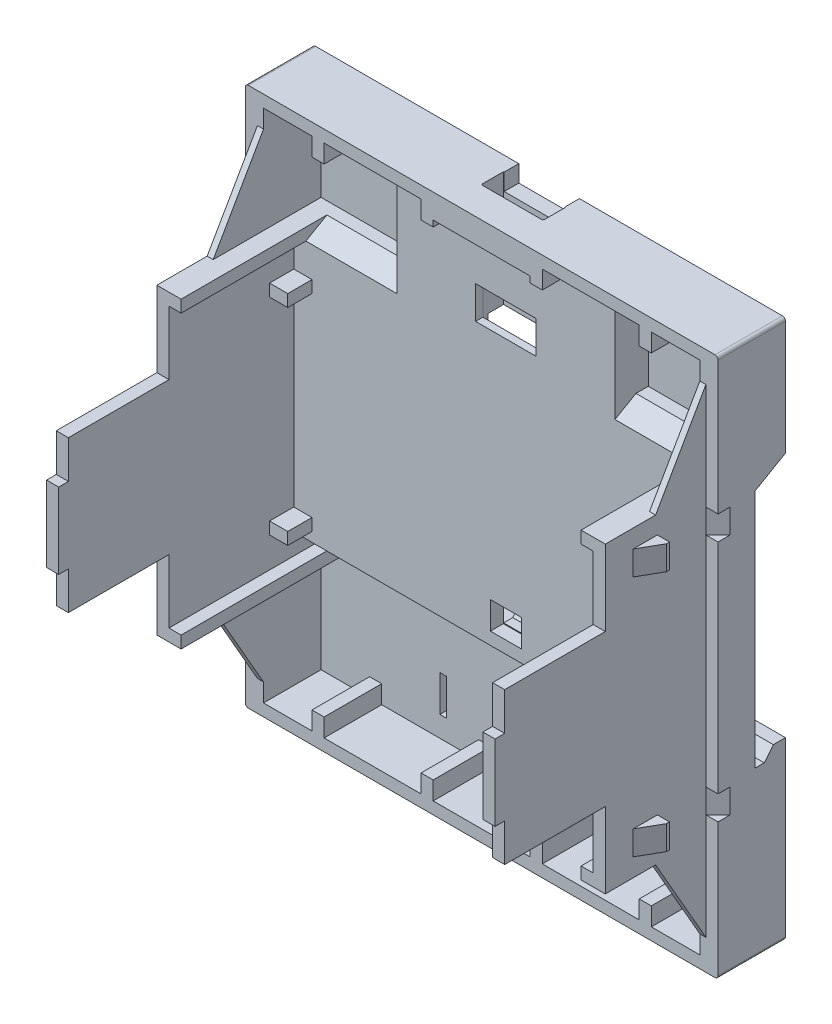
SolidWorks part; units mm, degrees
ref_plane "Alzado" through (0, 0, 0) normal (0, 0, 1) x (1, 0, 0)
ref_plane "Planta" through (0, 0, 0) normal (0, 1, 0) x (1, 0, 0)
ref_plane "Vista lateral" through (0, 0, 0) normal (1, 0, 0) x (0, 0, -1)
imported_body "GAINTA_D2MG_BASE_0.stp-1-solid1"
sketch "Croquis1" plane through (0, 0, 7.8033) normal (0, 0, 1) x (1, 0, 0)
  line L0 (23.9305, 33.3693) -> (25.6795, 33.3693) construction
  line L1 (-10.6205, 39.3693) -> (-8.8716, 39.3693)
  line L2 (-10.6205, 39.3693) -> (-10.6205, 33.3693)
  line L3 (-10.6205, 33.3693) -> (-8.8716, 33.3693)
  line L4 (-8.8716, 39.3693) -> (-8.8716, 33.3693)
  line L5 (-10.6205, -33.0907) -> (-8.8716, -33.0907)
  line L6 (-10.6205, -33.0907) -> (-10.6205, -39.0907)
  line L7 (-10.6205, -39.0907) -> (-8.8716, -39.0907)
  line L8 (-8.8716, -33.0907) -> (-8.8716, -39.0907)
  line L9 (25.6795, -33.0907) -> (23.9305, -33.0907)
  line L10 (25.6795, -33.0907) -> (25.6795, -39.0907)
  line L11 (25.6795, -39.0907) -> (23.9305, -39.0907)
  line L12 (23.9305, -33.0907) -> (23.9305, -39.0907)
  line L13 (25.6795, 39.3693) -> (23.9305, 39.3693)
  line L14 (25.6795, 39.3693) -> (25.6795, 33.3693)
  line L15 (25.6795, 33.3693) -> (23.9305, 33.3693)
  line L16 (23.9305, 39.3693) -> (23.9305, 33.3693)
  line L17 (23.9305, -43.3107) -> (23.9305, 43.5893) construction
extrude "Saliente-Extruir1" add sketch "Croquis1" against normal blind 7.13
sketch "Croquis2" plane through (0, 0, 10.3033) normal (0, 0, 1) x (1, 0, 0)
  line L4 (23.9305, 43.5893) -> (-8.8716, 43.5893)
  line L5 (-8.8716, 43.5893) -> (-8.8716, -43.3107)
  line L6 (-8.8716, -43.3107) -> (23.9305, -43.3107)
  line L7 (23.9305, -43.3107) -> (23.9305, 43.5893)
  line L8 (23.9305, 43.5893) -> (-8.8716, 43.5893)
  line L9 (-8.8716, 43.5893) -> (-8.8716, -43.3107)
  line L10 (-8.8716, -43.3107) -> (23.9305, -43.3107)
  line L11 (23.9305, -43.3107) -> (23.9305, 43.5893)
  dimension "D1" = 0
extrude "Cortar-Extruir1" cut sketch "Croquis2" against normal blind 2.5
sketch "Croquis3" plane through (0, 0, 7.8033) normal (0, 0, 1) x (1, 0, 0)
  line L0 (-10.6205, 0.0149) -> (25.6795, 0.0149) construction
  line L1 (-10.6205, 45.2393) -> (-10.6205, -45.2096) construction
  line L2 (25.6795, -45.2096) -> (25.6795, 45.2393) construction
  line L5 (25.6795, -45.2096) -> (-10.6205, -45.2096)
  line L7 (25.6795, -45.2096) -> (25.6795, -44.4896)
  line L8 (25.6795, -44.4896) -> (-10.6205, -44.4896)
  line L9 (-10.6205, -45.2096) -> (-10.6205, -44.4896)
  line L10 (-10.6205, 45.2393) -> (25.6795, 45.2393)
  line L11 (-10.6205, 45.2393) -> (-10.6205, 44.5193)
  line L12 (-10.6205, 44.5193) -> (25.6795, 44.5193)
  line L13 (25.6795, 45.2393) -> (25.6795, 44.5193)
extrude "Cortar-Extruir2" cut sketch "Croquis3" against normal blind 7.13
sketch "Croquis5" plane through (-10.6205, 0, 0) normal (-1, 0, 0) x (0, 0, 1)
  line L8 (0.6733, -44.4896) -> (7.8033, -44.4896)
  line L9 (7.8033, -44.4896) -> (7.8033, 44.5193)
  line L10 (7.8033, 44.5193) -> (0.6733, 44.5193)
  line L11 (0.6733, 44.5193) -> (0.6733, 25.1393)
  line L12 (0.6733, 25.1393) -> (5.6733, 22.2526)
  line L13 (5.6733, 22.2526) -> (5.6733, -17.8607)
  line L14 (5.6733, -17.8607) -> (0.6733, -17.8607)
  line L15 (0.6733, -17.8607) -> (0.6733, -44.4896)
  line L16 (0.6733, -44.4896) -> (7.8033, -44.4896)
  line L17 (7.8033, -44.4896) -> (7.8033, 44.5193)
  line L18 (7.8033, 44.5193) -> (0.6733, 44.5193)
  line L19 (0.6733, 44.5193) -> (0.6733, 25.1393)
  line L20 (0.6733, 25.1393) -> (5.6733, 22.2526)
  line L21 (5.6733, 22.2526) -> (5.6733, -17.8607)
  line L22 (5.6733, -17.8607) -> (0.6733, -17.8607)
  line L23 (0.6733, -17.8607) -> (0.6733, -44.4896)
  dimension "D1" = 0
extrude "Saliente-Extruir2" add sketch "Croquis5" along normal blind 20.85
sketch "Croquis6" plane through (25.6795, 0, 0) normal (1, 0, 0) x (0, 0, -1)
  line L8 (-7.8033, -44.4896) -> (-0.6733, -44.4896)
  line L9 (-0.6733, -44.4896) -> (-0.6733, -17.8607)
  line L10 (-0.6733, -17.8607) -> (-5.6733, -17.8607)
  line L11 (-5.6733, -17.8607) -> (-5.6733, 22.2526)
  line L12 (-5.6733, 22.2526) -> (-0.6733, 25.1393)
  line L13 (-0.6733, 25.1393) -> (-0.6733, 44.5193)
  line L14 (-0.6733, 44.5193) -> (-7.8033, 44.5193)
  line L15 (-7.8033, 44.5193) -> (-7.8033, -44.4896)
  line L16 (-7.8033, -44.4896) -> (-0.6733, -44.4896)
  line L17 (-0.6733, -44.4896) -> (-0.6733, -17.8607)
  line L18 (-0.6733, -17.8607) -> (-5.6733, -17.8607)
  line L19 (-5.6733, -17.8607) -> (-5.6733, 22.2526)
  line L20 (-5.6733, 22.2526) -> (-0.6733, 25.1393)
  line L21 (-0.6733, 25.1393) -> (-0.6733, 44.5193)
  line L22 (-0.6733, 44.5193) -> (-7.8033, 44.5193)
  line L23 (-7.8033, 44.5193) -> (-7.8033, -44.4896)
  dimension "D1" = 0
extrude "Saliente-Extruir3" add sketch "Croquis6" along normal blind 20.85
sketch "Croquis7" plane through (0, 0, 7.8033) normal (0, 0, 1) x (1, 0, 0)
  line L0 (-31.4705, -19.5457) -> (-27.4705, -19.5457) construction
  line L1 (-31.4705, -44.4896) -> (-31.4705, 44.5193) construction
  line L2 (46.5295, -41.633) -> (42.5295, -41.633) construction
  line L3 (46.5295, 44.5193) -> (46.5295, -44.4896) construction
  line L5 (-27.4705, -19.5457) -> (42.5295, -19.5457)
  line L6 (-27.4705, -19.5457) -> (-27.4705, -41.633)
  line L7 (-27.4705, -41.633) -> (42.5295, -41.633)
  line L8 (42.5295, -19.5457) -> (42.5295, -41.633)
extrude "Cortar-Extruir3" cut sketch "Croquis7" against normal blind 5.5
sketch "Croquis8" plane through (0, 0, 7.8033) normal (0, 0, 1) x (1, 0, 0)
  line L0 (42.5295, -41.633) -> (42.5295, -19.5457) construction
  line L1 (-27.4705, -41.633) -> (42.5295, -41.633)
  line L2 (-27.4705, -41.633) -> (-27.4705, -40.493)
  line L3 (-27.4705, -40.493) -> (42.5295, -40.493)
  line L4 (42.5295, -41.633) -> (42.5295, -40.493)
extrude "Saliente-Extruir4" add sketch "Croquis8" against normal blind 5.5
sketch "Croquis10" plane through (0, 0, 7.8033) normal (0, 0, 1) x (1, 0, 0)
  line L0 (42.5295, -40.493) -> (-27.4705, -40.493) construction
  line L1 (-31.4705, 44.5193) -> (-27.4705, 44.5193) construction
  line L2 (-31.4705, 44.5193) -> (-31.4705, 40.5193) construction
  line L3 (-31.4705, 40.5193) -> (-27.4705, 40.5193) construction
  line L4 (-27.4705, 44.5193) -> (-27.4705, 40.5193) construction
  line L5 (46.5295, -44.4896) -> (42.5328, -44.4896) construction
  line L6 (46.5295, -44.4896) -> (46.5295, -40.493) construction
  line L7 (46.5295, -40.493) -> (42.5328, -40.493) construction
  line L8 (42.5328, -44.4896) -> (42.5328, -40.493) construction
  line L9 (42.5295, -40.493) -> (-27.4705, -40.493) construction
  line L11 (-27.4705, 40.5193) -> (42.5328, 40.5193)
  line L12 (-27.4705, 40.5193) -> (-27.4705, -40.493)
  line L13 (-27.4705, -40.493) -> (42.5328, -40.493)
  line L14 (42.5328, 40.5193) -> (42.5328, -40.493)
  line L15 (-31.4705, 44.5193) -> (46.5295, 44.5193)
  line L16 (-31.4705, 44.5193) -> (-31.4705, -44.4896)
  line L17 (-31.4705, -44.4896) -> (46.5295, -44.4896)
  line L18 (46.5295, 44.5193) -> (46.5295, -44.4896)
extrude "Saliente-Extruir7" add sketch "Croquis10" along normal blind 4
sketch "Croquis12" plane through (0, 0, 11.8033) normal (0, 0, 1) x (1, 0, 0)
  line L0 (-27.4705, 0.0132) -> (-27.4705, 25.0132) construction
  line L1 (-27.4705, 40.5193) -> (-27.4705, -40.493) construction
  line L2 (-27.4705, 40.5193) -> (-27.4705, -19.5457) construction
  line L3 (42.5328, -40.493) -> (42.5328, 40.5193) construction
  line L4 (-27.4705, 25.0132) -> (-29.4705, 25.0132)
  line L5 (-27.4705, 25.0132) -> (-27.4705, -24.9868)
  line L6 (-27.4705, -24.9868) -> (-29.4705, -24.9868)
  line L7 (-29.4705, 25.0132) -> (-29.4705, -24.9868)
  line L8 (42.5328, 25.0132) -> (44.5328, 25.0132)
  line L9 (42.5328, 25.0132) -> (42.5328, -24.9868)
  line L10 (42.5328, -24.9868) -> (44.5328, -24.9868)
  line L11 (44.5328, 25.0132) -> (44.5328, -24.9868)
extrude "Saliente-Extruir8" add sketch "Croquis12" along normal blind 30
sketch "Croquis14" plane through (0, 0, 41.8033) normal (0, 0, 1) x (1, 0, 0)
  line L1 (-27.4705, -24.9868) -> (-25.4705, -24.9868)
  line L2 (-27.4705, -24.9868) -> (-27.4705, -22.9868)
  line L3 (-27.4705, -22.9868) -> (-25.4705, -22.9868)
  line L4 (-25.4705, -24.9868) -> (-25.4705, -22.9868)
  line L5 (42.5328, -24.9868) -> (40.5328, -24.9868)
  line L6 (42.5328, -24.9868) -> (42.5328, -22.9868)
  line L7 (42.5328, -22.9868) -> (40.5328, -22.9868)
  line L8 (40.5328, -24.9868) -> (40.5328, -22.9868)
extrude "Saliente-Extruir9" add sketch "Croquis14" against normal blind 39.5
sketch "Croquis15" plane through (0, 0, 41.8033) normal (0, 0, 1) x (1, 0, 0)
  line L1 (-27.4705, 25.0132) -> (-25.4705, 25.0132)
  line L2 (-27.4705, 25.0132) -> (-27.4705, 23.0132)
  line L3 (-27.4705, 23.0132) -> (-25.4705, 23.0132)
  line L4 (-25.4705, 25.0132) -> (-25.4705, 23.0132)
  line L5 (42.5328, 25.0132) -> (40.5328, 25.0132)
  line L6 (42.5328, 25.0132) -> (42.5328, 23.0132)
  line L7 (42.5328, 23.0132) -> (40.5328, 23.0132)
  line L8 (40.5328, 25.0132) -> (40.5328, 23.0132)
extrude "Saliente-Extruir10" add sketch "Croquis15" against normal blind 34
sketch "Croquis16" plane through (0, 0, 7.8033) normal (0, 0, 1) x (1, 0, 0)
  line L0 (-27.4705, -22.9868) -> (-27.4705, -17.9868) construction
  line L1 (-27.4705, -22.9868) -> (-27.4705, 23.0132) construction
  line L2 (-27.4705, 23.0132) -> (-27.4705, 18.0132) construction
  line L3 (7.5295, -19.5457) -> (7.5295, 0) construction
  line L4 (-27.4705, 18.0132) -> (-24.4705, 18.0132)
  line L5 (-27.4705, 18.0132) -> (-27.4705, 16.0132)
  line L6 (-27.4705, 16.0132) -> (-24.4705, 16.0132)
  line L7 (-24.4705, 18.0132) -> (-24.4705, 16.0132)
  line L8 (-27.4705, -17.9868) -> (-24.4705, -17.9868)
  line L9 (-27.4705, -17.9868) -> (-27.4705, -15.9868)
  line L10 (-27.4705, -15.9868) -> (-24.4705, -15.9868)
  line L11 (-24.4705, -17.9868) -> (-24.4705, -15.9868)
  line L12 (42.5295, -19.5457) -> (-27.4705, -19.5457) construction
  line L13 (39.5295, -17.9868) -> (39.5295, -15.9868)
  line L14 (42.5295, -15.9868) -> (39.5295, -15.9868)
  line L15 (42.5295, -17.9868) -> (42.5295, -15.9868)
  line L16 (42.5295, -17.9868) -> (39.5295, -17.9868)
  line L17 (39.5295, 18.0132) -> (39.5295, 16.0132)
  line L18 (42.5295, 16.0132) -> (39.5295, 16.0132)
  line L19 (42.5295, 18.0132) -> (42.5295, 16.0132)
  line L20 (42.5295, 18.0132) -> (39.5295, 18.0132)
extrude "Saliente-Extruir11" add sketch "Croquis16" along normal blind 4
sketch "Croquis17" plane through (0, 0, 41.8033) normal (0, 0, 1) x (1, 0, 0)
  line L0 (-27.4705, 0.0132) -> (-27.4705, 12.5132) construction
  line L1 (-27.4705, -22.9868) -> (-27.4705, 23.0132) construction
  line L2 (-27.4705, 0.0132) -> (-27.4705, -12.4868) construction
  line L3 (-29.4705, 25.0132) -> (-29.4705, -24.9868) construction
  line L4 (-29.4705, -12.4868) -> (-25.4705, -12.4868)
  line L5 (-29.4705, -12.4868) -> (-29.4705, -24.9868)
  line L6 (-29.4705, -24.9868) -> (-25.4705, -24.9868)
  line L7 (-25.4705, -12.4868) -> (-25.4705, -24.9868)
  line L8 (7.5295, -19.5457) -> (7.5295, 0) construction
  line L9 (-29.4705, 25.0132) -> (-25.4705, 25.0132)
  line L10 (-29.4705, 25.0132) -> (-29.4705, 12.5132)
  line L11 (-29.4705, 12.5132) -> (-25.4705, 12.5132)
  line L12 (-25.4705, 25.0132) -> (-25.4705, 12.5132)
  line L13 (42.5295, -19.5457) -> (-27.4705, -19.5457) construction
  line L15 (44.5328, 25.0132) -> (40.5328, 25.0132)
  line L16 (44.5328, 25.0132) -> (44.5328, 12.5132)
  line L17 (44.5328, 12.5132) -> (40.5328, 12.5132)
  line L18 (40.5328, 25.0132) -> (40.5328, 12.5132)
  line L19 (44.5328, -24.9868) -> (40.5328, -24.9868)
  line L20 (44.5328, -24.9868) -> (44.5328, -12.4868)
  line L21 (44.5328, -12.4868) -> (40.5328, -12.4868)
  line L22 (40.5328, -24.9868) -> (40.5328, -12.4868)
extrude "Cortar-Extruir5" cut sketch "Croquis17" against normal blind 13.4
sketch "Croquis18" plane through (0, 0, 41.8033) normal (0, 0, 1) x (1, 0, 0)
  line L0 (42.5328, 12.5132) -> (42.5328, -12.4868) construction
  line L1 (-29.4705, 12.5132) -> (-27.4705, 12.5132)
  line L2 (-29.4705, 12.5132) -> (-29.4705, -12.4868)
  line L3 (-29.4705, -12.4868) -> (-27.4705, -12.4868)
  line L4 (-27.4705, 12.5132) -> (-27.4705, -12.4868)
  line L5 (42.5328, 12.5132) -> (44.5328, 12.5132)
  line L6 (42.5328, 12.5132) -> (42.5328, -12.4868)
  line L7 (42.5328, -12.4868) -> (44.5328, -12.4868)
  line L8 (44.5328, 12.5132) -> (44.5328, -12.4868)
  line L9 (42.5328, 12.5132) -> (44.5328, 12.5132) construction
extrude "Saliente-Extruir12" add sketch "Croquis18" along normal blind 3.2
sketch "Croquis19" plane through (0, 0, 45.0033) normal (0, 0, 1) x (1, 0, 0)
  line L0 (-27.4705, 0.0132) -> (-27.4705, 6.2632) construction
  line L1 (-27.4705, 16.0132) -> (-27.4705, -15.9868) construction
  line L2 (-29.4705, 25.0132) -> (-29.4705, -24.9868) construction
  line L3 (-27.4705, 6.2632) -> (-29.4705, 6.2632)
  line L4 (-27.4705, 6.2632) -> (-27.4705, -6.2368)
  line L5 (-27.4705, -6.2368) -> (-29.4705, -6.2368)
  line L6 (-29.4705, 6.2632) -> (-29.4705, -6.2368)
  line L7 (44.5328, -24.9868) -> (44.5328, 25.0132) construction
  line L8 (44.5328, 6.2632) -> (42.5328, 6.2632)
  line L9 (44.5328, 6.2632) -> (44.5328, -6.2368)
  line L10 (44.5328, -6.2368) -> (42.5328, -6.2368)
  line L11 (42.5328, 6.2632) -> (42.5328, -6.2368)
  line L12 (42.5328, 12.5132) -> (42.5328, -12.4868) construction
extrude "Saliente-Extruir13" add sketch "Croquis19" along normal blind 2.1
sketch "Croquis22" plane through (44.5328, 0, 0) normal (1, 0, 0) x (0, 0, -1)
  line L0 (-11.8033, -44.4896) -> (-11.8033, -39.4896) construction
  line L1 (-11.8033, -44.4896) -> (-11.8033, 44.5193) construction
  line L2 (-11.8033, -24.9868) -> (-20.1033, -24.9868)
  line L3 (-28.4033, -24.9868) -> (-11.8033, -24.9868) construction
  line L4 (-20.1033, -24.9868) -> (-11.8033, -39.4896)
  line L5 (-11.8033, -39.4896) -> (-11.8033, -24.9868)
  line L8 (-11.8033, 39.516) -> (-11.8033, 25.0132)
  line L9 (-20.1033, 25.0132) -> (-11.8033, 39.516)
  line L10 (-11.8033, 25.0132) -> (-20.1033, 25.0132)
extrude "Saliente-Extruir14" add sketch "Croquis22" against normal blind 1
sketch "Croquis23" plane through (-29.4705, 0, 0) normal (-1, 0, 0) x (0, 0, 1)
  line L0 (11.8033, 39.516) -> (11.8033, 25.0132)
  line L1 (11.8033, 25.0132) -> (20.1033, 25.0132)
  line L2 (28.4033, 25.0132) -> (11.8033, 25.0132) construction
  line L3 (20.1033, 25.0132) -> (11.8033, 39.516)
  line L4 (11.8033, -24.9868) -> (11.8033, -39.4896)
  line L5 (11.8033, -39.4896) -> (20.1033, -24.9868)
  line L6 (28.4033, -24.9868) -> (11.8033, -24.9868) construction
  line L7 (20.1033, -24.9868) -> (11.8033, -24.9868)
extrude "Saliente-Extruir15" add sketch "Croquis23" against normal blind 1
sketch "Croquis24" plane through (0, 0, 11.8033) normal (0, 0, 1) x (1, 0, 0)
  line L1 (-27.4705, 40.5193) -> (-28.4705, 40.5193)
  line L2 (-27.4705, 40.5193) -> (-27.4705, 25.0132)
  line L3 (-27.4705, 25.0132) -> (-28.4705, 25.0132)
  line L4 (-28.4705, 40.5193) -> (-28.4705, 25.0132)
  line L5 (-27.4705, -40.493) -> (-28.4705, -40.493)
  line L6 (-27.4705, -40.493) -> (-27.4705, -24.9868)
  line L7 (-27.4705, -24.9868) -> (-28.4705, -24.9868)
  line L8 (-28.4705, -40.493) -> (-28.4705, -24.9868)
  line L13 (42.5328, 40.5193) -> (43.5328, 40.5193)
  line L14 (42.5328, 40.5193) -> (42.5328, 25.0132)
  line L15 (42.5328, 25.0132) -> (43.5328, 25.0132)
  line L16 (43.5328, 40.5193) -> (43.5328, 25.0132)
  line L17 (42.5295, -24.9868) -> (43.5328, -24.9868)
  line L18 (42.5295, -24.9868) -> (42.5295, -40.493)
  line L19 (42.5295, -40.493) -> (43.5328, -40.493)
  line L20 (43.5328, -24.9868) -> (43.5328, -40.493)
extrude "Cortar-Extruir7" cut sketch "Croquis24" against normal blind 9.5
sketch "Croquis25" plane through (0, 0, 11.8033) normal (0, 0, 1) x (1, 0, 0)
  line L0 (7.5311, -40.493) -> (-28.4705, -40.493) construction
  line L1 (43.5328, -40.493) -> (-28.4705, -40.493) construction
  line L2 (-10.4697, -40.493) -> (-19.4697, -40.493) construction
  line L3 (-20.4697, -40.493) -> (-18.4697, -40.493)
  line L4 (-18.4697, -40.493) -> (-18.4697, -39.493)
  line L5 (-18.4697, -39.493) -> (-20.4697, -39.493)
  line L6 (-20.4697, -39.493) -> (-20.4697, -40.493)
  line L7 (-2.4697, -40.493) -> (-0.4697, -40.493)
  line L8 (-0.4697, -40.493) -> (-0.4697, -39.493)
  line L9 (-0.4697, -39.493) -> (-2.4697, -39.493)
  line L10 (-2.4697, -39.493) -> (-2.4697, -40.493)
  line L11 (15.5303, -40.493) -> (17.5303, -40.493)
  line L12 (17.5303, -40.493) -> (17.5303, -39.493)
  line L13 (17.5303, -39.493) -> (15.5303, -39.493)
  line L14 (15.5303, -39.493) -> (15.5303, -40.493)
  line L15 (33.5303, -40.493) -> (35.5303, -40.493)
  line L16 (35.5303, -40.493) -> (35.5303, -39.493)
  line L17 (35.5303, -39.493) -> (33.5303, -39.493)
  line L18 (33.5303, -39.493) -> (33.5303, -40.493)
  point P10 (-19.4697, -40.493)
  point P17 (-1.4697, -40.493)
  point P22 (16.5303, -40.493)
  point P27 (34.5303, -40.493)
  dimension "D1" = 4
extrude "Saliente-Extruir17" add sketch "Croquis25" against normal blind 9.5
sketch "Croquis26" plane through (0, 0, 11.8033) normal (0, 0, 1) x (1, 0, 0)
  line L0 (17.5303, -40.493) -> (33.5303, -40.493) construction
  line L1 (-20.4697, -40.493) -> (-28.4705, -40.493)
  line L2 (-20.4697, -40.493) -> (-20.4697, -42.493)
  line L3 (-20.4697, -42.493) -> (-28.4705, -42.493)
  line L4 (-28.4705, -40.493) -> (-28.4705, -42.493)
  line L5 (-18.4697, -40.493) -> (-2.4697, -40.493)
  line L6 (-18.4697, -40.493) -> (-18.4697, -42.493)
  line L7 (-18.4697, -42.493) -> (-2.4697, -42.493)
  line L8 (-2.4697, -40.493) -> (-2.4697, -42.493)
  line L9 (-0.4697, -40.493) -> (15.5303, -40.493)
  line L10 (-0.4697, -40.493) -> (-0.4697, -42.493)
  line L11 (-0.4697, -42.493) -> (15.5303, -42.493)
  line L12 (15.5303, -40.493) -> (15.5303, -42.493)
  line L13 (17.5303, -40.493) -> (33.5303, -40.493)
  line L14 (17.5303, -40.493) -> (17.5303, -42.493)
  line L15 (17.5303, -42.493) -> (33.5303, -42.493)
  line L16 (33.5303, -40.493) -> (33.5303, -42.493)
  line L17 (35.5303, -40.493) -> (43.5328, -40.493) construction
  line L18 (35.5303, -40.493) -> (43.5328, -40.493)
  line L19 (35.5303, -40.493) -> (35.5303, -42.493)
  line L20 (35.5303, -42.493) -> (43.5328, -42.493)
  line L21 (43.5328, -40.493) -> (43.5328, -42.493)
  line L22 (43.5328, -40.493) -> (35.5303, -40.493) construction
extrude "Cortar-Extruir8" cut sketch "Croquis26" against normal blind 9.5
sketch "Croquis27" plane through (0, 0, 11.8033) normal (0, 0, 1) x (1, 0, 0)
  line L0 (-28.4705, 40.5193) -> (-19.4705, 40.5193) construction
  line L1 (43.5328, 40.5193) -> (-28.4705, 40.5193) construction
  line L2 (-20.4705, 40.5193) -> (-18.4705, 40.5193)
  line L3 (2.5295, 40.5193) -> (-27.4705, 40.5193) construction
  line L4 (-18.4705, 40.5193) -> (-18.4705, 39.5193)
  line L5 (-18.4705, 39.5193) -> (-20.4705, 39.5193)
  line L6 (-20.4705, 39.5193) -> (-20.4705, 40.5193)
  line L7 (-2.4705, 40.5193) -> (-0.4705, 40.5193)
  line L8 (-0.4705, 40.5193) -> (-0.4705, 39.5193)
  line L9 (-0.4705, 39.5193) -> (-2.4705, 39.5193)
  line L10 (-2.4705, 39.5193) -> (-2.4705, 40.5193)
  line L11 (15.5295, 40.5193) -> (17.5295, 40.5193)
  line L12 (17.5295, 40.5193) -> (17.5295, 39.5193)
  line L13 (17.5295, 39.5193) -> (15.5295, 39.5193)
  line L14 (15.5295, 39.5193) -> (15.5295, 40.5193)
  line L15 (33.5295, 40.5193) -> (35.5295, 40.5193)
  line L16 (35.5295, 40.5193) -> (35.5295, 39.5193)
  line L17 (35.5295, 39.5193) -> (33.5295, 39.5193)
  line L18 (33.5295, 39.5193) -> (33.5295, 40.5193)
  point P10 (-19.4705, 40.5193)
  point P17 (-1.4705, 40.5193)
  point P22 (16.5295, 40.5193)
  point P27 (34.5295, 40.5193)
  dimension "D1" = 4
extrude "Saliente-Extruir18" add sketch "Croquis27" against normal blind 4
sketch "Croquis29" plane through (0, 0, 11.8033) normal (0, 0, 1) x (1, 0, 0)
  line L1 (-20.4705, 40.5193) -> (-28.4705, 40.5193)
  line L2 (-20.4705, 40.5193) -> (-20.4705, 42.5193)
  line L3 (-20.4705, 42.5193) -> (-28.4705, 42.5193)
  line L4 (-28.4705, 40.5193) -> (-28.4705, 42.5193)
  line L5 (-18.4705, 40.5193) -> (-2.4705, 40.5193)
  line L6 (-18.4705, 40.5193) -> (-18.4705, 42.5193)
  line L7 (-18.4705, 42.5193) -> (-2.4705, 42.5193)
  line L8 (-2.4705, 40.5193) -> (-2.4705, 42.5193)
  line L13 (33.5295, 40.5193) -> (17.5295, 40.5193)
  line L14 (33.5295, 40.5193) -> (33.5295, 42.5193)
  line L15 (33.5295, 42.5193) -> (17.5295, 42.5193)
  line L16 (17.5295, 40.5193) -> (17.5295, 42.5193)
  line L17 (35.5295, 40.5193) -> (43.5328, 40.5193)
  line L18 (35.5295, 40.5193) -> (35.5295, 42.5193)
  line L19 (35.5295, 42.5193) -> (43.5328, 42.5193)
  line L20 (43.5328, 40.5193) -> (43.5328, 42.5193)
extrude "Cortar-Extruir10" cut sketch "Croquis29" against normal blind 5.5
sketch "Croquis31" plane through (0, 0, 7.8033) normal (0, 0, 1) x (1, 0, 0)
  line L4 (-10.4705, 25.0132) -> (-10.4705, 40.5193)
  line L5 (25.5295, 40.5193) -> (25.5295, 25.0132)
  line L8 (-25.4705, 25.0132) -> (-10.4705, 25.0132)
  line L9 (40.5328, 25.0132) -> (25.5295, 25.0132)
  line L40 (33.5295, 39.5193) -> (33.5295, 40.5193)
  line L41 (33.5295, 40.5193) -> (17.5295, 40.5193)
  line L42 (17.5295, 40.5193) -> (17.5295, 39.5193)
  line L43 (17.5295, 39.5193) -> (15.5295, 39.5193)
  line L44 (15.5295, 39.5193) -> (15.5295, 40.5193)
  line L45 (15.5295, 40.5193) -> (12.5295, 40.5193)
  line L46 (12.5295, 40.5193) -> (12.5295, 36.6393)
  line L47 (12.5295, 36.6393) -> (2.5295, 36.6393)
  line L48 (2.5295, 36.6393) -> (2.5295, 40.5193)
  line L49 (2.5295, 40.5193) -> (-0.4705, 40.5193)
  line L50 (-0.4705, 40.5193) -> (-0.4705, 39.5193)
  line L51 (-0.4705, 39.5193) -> (-2.4705, 39.5193)
  line L52 (-2.4705, 39.5193) -> (-2.4705, 40.5193)
  line L53 (-2.4705, 40.5193) -> (-18.4705, 40.5193)
  line L54 (-18.4705, 40.5193) -> (-18.4705, 39.5193)
  line L55 (-18.4705, 39.5193) -> (-20.4705, 39.5193)
  line L56 (-20.4705, 39.5193) -> (-20.4705, 40.5193)
  line L57 (-20.4705, 40.5193) -> (-27.4705, 40.5193)
  line L58 (-27.4705, 40.5193) -> (-27.4705, 25.0132)
  line L59 (-27.4705, 25.0132) -> (-25.4705, 25.0132)
  line L60 (-25.4705, 25.0132) -> (-25.4705, 23.0132)
  line L61 (-25.4705, 23.0132) -> (-27.4705, 23.0132)
  line L62 (-27.4705, 23.0132) -> (-27.4705, 18.0132)
  line L63 (-27.4705, 18.0132) -> (-24.4705, 18.0132)
  line L64 (-24.4705, 18.0132) -> (-24.4705, 16.0132)
  line L65 (-24.4705, 16.0132) -> (-27.4705, 16.0132)
  line L66 (-27.4705, 16.0132) -> (-27.4705, -15.9868)
  line L67 (-27.4705, -15.9868) -> (-24.4705, -15.9868)
  line L68 (-24.4705, -15.9868) -> (-24.4705, -17.9868)
  line L69 (-24.4705, -17.9868) -> (-27.4705, -17.9868)
  line L70 (-27.4705, -17.9868) -> (-27.4705, -19.5457)
  line L71 (-27.4705, -19.5457) -> (42.5311, -19.5457)
  line L72 (42.5311, -19.5457) -> (42.5328, 23.0132)
  line L73 (42.5328, 23.0132) -> (40.5328, 23.0132)
  line L74 (40.5328, 23.0132) -> (40.5328, 25.0132)
  line L75 (40.5328, 25.0132) -> (42.5328, 25.0132)
  line L76 (42.5328, 25.0132) -> (42.5328, 40.5193)
  line L77 (42.5328, 40.5193) -> (35.5295, 40.5193)
  line L78 (35.5295, 40.5193) -> (35.5295, 39.5193)
  line L79 (35.5295, 39.5193) -> (33.5295, 39.5193)
  line L80 (33.5295, 39.5193) -> (33.5295, 40.5193)
  line L81 (33.5295, 40.5193) -> (25.5295, 40.5193)
  line L93 (-10.4705, 40.5193) -> (-18.4705, 40.5193)
  line L94 (-18.4705, 40.5193) -> (-18.4705, 39.5193)
  line L95 (-18.4705, 39.5193) -> (-20.4705, 39.5193)
  line L96 (-20.4705, 39.5193) -> (-20.4705, 40.5193)
  line L97 (-20.4705, 40.5193) -> (-27.4705, 40.5193)
  line L98 (-27.4705, 40.5193) -> (-27.4705, 25.0132)
  line L99 (-27.4705, 25.0132) -> (-25.4705, 25.0132)
  line L115 (40.5328, 25.0132) -> (42.5328, 25.0132)
  line L116 (42.5328, 25.0132) -> (42.5328, 40.5193)
  line L117 (42.5328, 40.5193) -> (35.5295, 40.5193)
  line L118 (35.5295, 40.5193) -> (35.5295, 39.5193)
  line L119 (35.5295, 39.5193) -> (33.5295, 39.5193)
  dimension "D1" = 0
extrude "Cortar-Extruir12" cut sketch "Croquis31" against normal blind 5.5
sketch "Croquis32" plane through (0, 0, 6.3033) normal (0, 0, 1) x (1, 0, 0)
  line L0 (-10.4705, 40.5193) -> (-10.4705, 42.5193)
  line L1 (25.5295, 40.5193) -> (25.5295, 42.5193)
  line L4 (-20.4705, 40.5193) -> (-20.4705, 42.5193)
  line L5 (-18.4705, 42.5193) -> (-18.4705, 40.5193)
  line L6 (-18.4705, 40.5193) -> (-10.4705, 40.5193)
  line L7 (-10.4705, 40.5193) -> (-2.4705, 40.5193)
  line L8 (-2.4705, 40.5193) -> (-2.4705, 42.5193)
  line L9 (-2.4705, 42.5193) -> (-18.4705, 42.5193)
  line L10 (-18.4705, 42.5193) -> (-18.4705, 40.5193)
  line L11 (-18.4705, 40.5193) -> (-10.4705, 40.5193)
  line L14 (-10.4705, 42.5193) -> (-18.4705, 42.5193)
  line L15 (-20.4705, 42.5193) -> (-28.4705, 42.5193)
  line L16 (-28.4705, 42.5193) -> (-28.4705, 40.5193)
  line L17 (-28.4705, 40.5193) -> (-20.4705, 40.5193)
  line L18 (-20.4705, 40.5193) -> (-20.4705, 42.5193)
  line L19 (-20.4705, 42.5193) -> (-28.4705, 42.5193)
  line L20 (-28.4705, 42.5193) -> (-28.4705, 40.5193)
  line L21 (-28.4705, 40.5193) -> (-20.4705, 40.5193)
  line L22 (35.5295, 42.5193) -> (35.5295, 40.5193)
  line L23 (33.5295, 40.5193) -> (33.5295, 42.5193)
  line L24 (33.5295, 42.5193) -> (17.5295, 42.5193)
  line L25 (17.5295, 42.5193) -> (17.5295, 40.5193)
  line L26 (17.5295, 40.5193) -> (25.5295, 40.5193)
  line L27 (25.5295, 40.5193) -> (33.5295, 40.5193)
  line L28 (33.5295, 40.5193) -> (33.5295, 42.5193)
  line L29 (33.5295, 42.5193) -> (25.5295, 42.5193)
  line L32 (25.5295, 40.5193) -> (33.5295, 40.5193)
  line L33 (35.5295, 40.5193) -> (43.5328, 40.5193)
  line L34 (43.5328, 40.5193) -> (43.5328, 42.5193)
  line L35 (43.5328, 42.5193) -> (35.5295, 42.5193)
  line L36 (35.5295, 42.5193) -> (35.5295, 40.5193)
  line L37 (35.5295, 40.5193) -> (43.5328, 40.5193)
  line L38 (43.5328, 40.5193) -> (43.5328, 42.5193)
  line L39 (43.5328, 42.5193) -> (35.5295, 42.5193)
  dimension "D1" = 0
  dimension "D2" = 0
  dimension "D3" = 0
  dimension "D4" = 0
extrude "Cortar-Extruir14" cut sketch "Croquis32" against normal blind 4
chamfer "Chaflán1" distance 2 angle 60 2 edges at (-17.9705, 25.0132, 7.8033) (33.0311, 25.0132, 7.8033)
sketch "Croquis33" plane through (-29.4705, 0, 0) normal (-1, 0, 0) x (0, 0, 1)
  line L0 (11.8033, 0.0132) -> (11.8033, -19.9868) construction
  line L1 (11.8033, 39.516) -> (11.8033, -39.4896) construction
  line L2 (11.8033, 44.5193) -> (11.8033, -44.4896) construction
  line L3 (11.8033, -19.9868) -> (19.8033, -19.9868) construction
  line L4 (19.8033, -19.9868) -> (19.8033, -17.9868)
  line L5 (19.8033, -17.9868) -> (23.8033, -17.9868)
  line L6 (23.8033, -17.9868) -> (23.8033, -21.9868)
  line L7 (23.8033, -21.9868) -> (19.8033, -21.9868)
  line L8 (19.8033, -21.9868) -> (19.8033, -19.9868)
  line L9 (11.8033, 0.0132) -> (16.9922, 0.0132) construction
  line L10 (19.8033, 22.0132) -> (19.8033, 20.0132)
  line L11 (23.8033, 22.0132) -> (19.8033, 22.0132)
  line L12 (23.8033, 18.0132) -> (23.8033, 22.0132)
  line L13 (19.8033, 18.0132) -> (23.8033, 18.0132)
  line L14 (19.8033, 20.0132) -> (19.8033, 18.0132)
extrude "Saliente-Extruir19" add sketch "Croquis33" along normal blind 2
sketch "Croquis34" plane through (0, -21.9868, 0) normal (0, -1, 0) x (1, 0, 0)
  line L0 (-31.4705, 19.8033) -> (-31.4705, 20.3033) construction
  line L1 (-31.4705, 19.8033) -> (-31.4705, 23.8033) construction
  line L2 (-31.4705, 20.3033) -> (-31.4705, 23.8033)
  line L3 (-31.4705, 23.8033) -> (-29.4705, 23.8033)
  line L4 (-29.4705, 23.8033) -> (-31.4705, 20.3033)
extrude "Cortar-Extruir15" cut sketch "Croquis34" against normal blind 44
sketch "Croquis35" plane through (44.5328, 0, 0) normal (1, 0, 0) x (0, 0, -1)
  line L0 (-11.8033, 0.0132) -> (-11.8033, 20.0132) construction
  line L1 (-11.8033, -39.4896) -> (-11.8033, 39.516) construction
  line L2 (-11.8033, 20.0132) -> (-19.8033, 20.0132) construction
  line L3 (-19.8033, 20.0132) -> (-19.8033, 22.0132)
  line L4 (-19.8033, 22.0132) -> (-23.8033, 22.0132)
  line L5 (-23.8033, 22.0132) -> (-23.8033, 18.0132)
  line L6 (-23.8033, 18.0132) -> (-19.8033, 18.0132)
  line L7 (-19.8033, 18.0132) -> (-19.8033, 20.0132)
  line L8 (-11.8033, 0.0132) -> (-16.5224, 0.0132) construction
  line L9 (-19.8033, -17.9868) -> (-19.8033, -19.9868)
  line L10 (-23.8033, -17.9868) -> (-19.8033, -17.9868)
  line L11 (-23.8033, -21.9868) -> (-23.8033, -17.9868)
  line L12 (-19.8033, -21.9868) -> (-23.8033, -21.9868)
  line L13 (-19.8033, -19.9868) -> (-19.8033, -21.9868)
extrude "Saliente-Extruir20" add sketch "Croquis35" along normal blind 2
sketch "Croquis36" plane through (0, -21.9868, 0) normal (0, -1, 0) x (1, 0, 0)
  line L0 (46.5328, 19.8033) -> (46.5328, 20.3033) construction
  line L1 (46.5328, 23.8033) -> (46.5328, 19.8033) construction
  line L2 (46.5328, 20.3033) -> (44.5328, 23.8033)
  line L3 (44.5328, 23.8033) -> (46.5328, 23.8033)
  line L4 (46.5328, 23.8033) -> (46.5328, 20.3033)
extrude "Cortar-Extruir16" cut sketch "Croquis36" against normal blind 44
sketch "Croquis37" plane through (0, 0, 47.1033) normal (0, 0, 1) x (1, 0, 0)
  line L4 (-27.4705, -6.2368) -> (-27.4705, 6.2632)
  line L5 (-27.4705, 6.2632) -> (-29.4705, 6.2632)
  line L6 (-29.4705, 6.2632) -> (-29.4705, -6.2368)
  line L7 (-29.4705, -6.2368) -> (-27.4705, -6.2368)
  line L8 (-27.4705, -6.2368) -> (-27.4705, 6.2632)
  line L9 (-27.4705, 6.2632) -> (-29.4705, 6.2632)
  line L10 (-29.4705, 6.2632) -> (-29.4705, -6.2368)
  line L11 (-29.4705, -6.2368) -> (-27.4705, -6.2368)
  line L12 (44.5328, -6.2368) -> (44.5328, 6.2632)
  line L13 (44.5328, 6.2632) -> (42.5328, 6.2632)
  line L14 (42.5328, 6.2632) -> (42.5328, -6.2368)
  line L15 (42.5328, -6.2368) -> (44.5328, -6.2368)
  line L16 (44.5328, -6.2368) -> (44.5328, 6.2632)
  line L17 (44.5328, 6.2632) -> (42.5328, 6.2632)
  line L18 (42.5328, 6.2632) -> (42.5328, -6.2368)
  line L19 (42.5328, -6.2368) -> (44.5328, -6.2368)
  dimension "D1" = 0
  dimension "D2" = 0
extrude "Cortar-Extruir18" cut sketch "Croquis37" against normal blind 0.5
sketch "Croquis40" plane through (46.5295, 0, 0) normal (1, 0, 0) x (0, 0, -1)
  line L0 (-11.8033, -44.4896) -> (-11.8033, 44.5193) construction
  line L1 (-11.8033, -21.9868) -> (-9.8033, -21.9868)
  line L2 (-11.8033, -21.9868) -> (-11.8033, -17.9868)
  line L3 (-11.8033, -17.9868) -> (-9.8033, -17.9868)
  line L4 (-9.8033, -21.9868) -> (-9.8033, -17.9868)
  line L5 (-11.8033, 18.0132) -> (-11.8033, 22.0132)
  line L6 (-11.8033, 18.0132) -> (-9.8033, 18.0132)
  line L7 (-9.8033, 18.0132) -> (-9.8033, 22.0132)
  line L8 (-11.8033, 22.0132) -> (-9.8033, 22.0132)
  dimension "D1" = 2
extrude "Cortar-Extruir20" cut sketch "Croquis40" against normal blind 1.99
sketch "Croquis42" plane through (0, -17.9868, 0) normal (0, -1, 0) x (1, 0, 0)
  line L0 (46.5295, 9.8033) -> (44.5395, 11.8033)
  line L1 (44.5395, 11.8033) -> (44.5395, 9.8033)
  line L2 (44.5395, 9.8033) -> (44.5395, 11.8033) construction
  line L3 (44.5395, 9.8033) -> (46.5295, 9.8033)
extrude "Saliente-Extruir26" add sketch "Croquis42" along normal blind 4
sketch "Croquis43" plane through (0, 22.0132, 0) normal (0, -1, 0) x (1, 0, 0)
  line L0 (46.5295, 9.8033) -> (44.5328, 11.8033)
  line L1 (44.5328, 11.8033) -> (44.5328, 9.8033)
  line L2 (44.5328, 9.8033) -> (46.5295, 9.8033)
extrude "Saliente-Extruir27" add sketch "Croquis43" along normal blind 4
sketch "Croquis44" plane through (-31.4705, 0, 0) normal (-1, 0, 0) x (0, 0, 1)
  line L0 (11.8033, 44.5193) -> (11.8033, -44.4896) construction
  line L1 (11.8033, 22.0132) -> (9.8033, 22.0132)
  line L2 (11.8033, 22.0132) -> (11.8033, 18.0132)
  line L3 (11.8033, 18.0132) -> (9.8033, 18.0132)
  line L4 (9.8033, 22.0132) -> (9.8033, 18.0132)
  line L6 (11.8033, -17.9868) -> (9.8033, -17.9868)
  line L7 (11.8033, -17.9868) -> (11.8033, -21.9868)
  line L8 (11.8033, -21.9868) -> (9.8033, -21.9868)
  line L9 (9.8033, -17.9868) -> (9.8033, -21.9868)
extrude "Cortar-Extruir21" cut sketch "Croquis44" against normal blind 2
sketch "Croquis45" plane through (0, -21.9868, 0) normal (0, 1, 0) x (1, 0, 0)
  line L0 (-31.4705, -9.8033) -> (-29.4705, -11.8033)
  line L1 (-29.4705, -11.8033) -> (-29.4705, -9.8033)
  line L2 (-29.4705, -9.8033) -> (-31.4705, -9.8033)
extrude "Saliente-Extruir28" add sketch "Croquis45" along normal blind 4
sketch "Croquis46" plane through (0, 18.0132, 0) normal (0, 1, 0) x (1, 0, 0)
  line L0 (-29.4705, -11.8033) -> (-31.4705, -9.8033)
  line L1 (-31.4705, -9.8033) -> (-29.4705, -9.8033)
  line L2 (-29.4705, -9.8033) -> (-29.4705, -11.8033)
extrude "Saliente-Extruir29" add sketch "Croquis46" along normal blind 4
sketch "Croquis48" plane through (46.5295, 0, 0) normal (1, 0, 0) x (0, 0, -1)
  line L0 (-0.6733, -17.8607) -> (-0.6733, -15.5107)
  line L1 (-0.6733, -15.5107) -> (-2.6733, -15.5107)
  line L2 (-2.6733, -15.5107) -> (-4.1733, -17.3607)
  line L3 (-4.1733, -17.3607) -> (-5.6733, -17.3607)
  line L4 (-5.6733, -17.8607) -> (-5.6733, 22.2526) construction
  line L5 (-4.1733, -17.3607) -> (-5.6733, -17.3607) construction
  line L6 (-5.6733, -17.3607) -> (-5.6733, -17.8607)
  line L7 (-5.6733, -17.8607) -> (-0.6733, -17.8607)
extrude "Saliente-Extruir30" add sketch "Croquis48" against normal blind 5
sketch "Croquis49" plane through (-31.4705, 0, 0) normal (-1, 0, 0) x (0, 0, 1)
  line L0 (0.6733, -17.8607) -> (0.6733, -15.5107)
  line L1 (0.6733, -15.5107) -> (2.6733, -15.5107)
  line L2 (2.6733, -15.5107) -> (4.1733, -17.3607)
  line L3 (4.1733, -17.3607) -> (5.6733, -17.3607)
  line L4 (5.6733, -17.3607) -> (5.6733, -17.8607)
  line L5 (5.6733, -17.8607) -> (0.6733, -17.8607)
extrude "Saliente-Extruir31" add sketch "Croquis49" against normal blind 5
fillet "Redondeo1" radius 0.5 4 edges at (-31.4705, 44.5193, 6.2383) (46.5295, 44.5193, 6.2383) (46.5295, -44.4896, 6.2383) (-31.4705, -44.4896, 6.2383)
